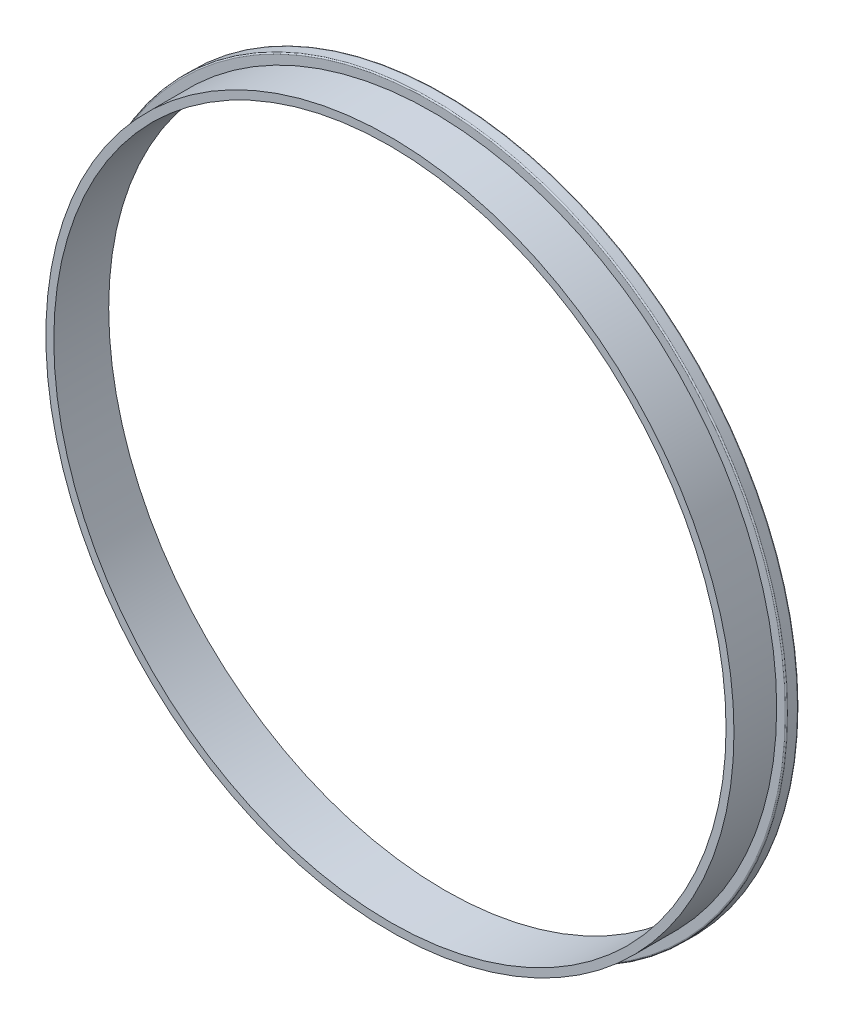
SolidWorks part; units mm, degrees
ref_plane "前视基准面" through (0, 0, 0) normal (0, 0, 1) x (1, 0, 0)
ref_plane "上视基准面" through (0, 0, 0) normal (0, 1, 0) x (1, 0, 0)
ref_plane "右视基准面" through (0, 0, 0) normal (1, 0, 0) x (0, 0, -1)
sketch "草图1" plane through (0, 0, 0) normal (0, 0, 1) x (1, 0, 0)
  circle A0 centre (0, 0) radius 58
  circle A1 centre (0, 0) radius 55.1
  dimension "D1" = 116
  dimension "D2" = 110.2
extrude "凸台-拉伸1" add sketch "草图1" along normal blind 9
sketch "草图2" plane through (0, 0, 9) normal (0, 0, 1) x (1, 0, 0)
  circle A0 centre (0, 0) radius 56.4
  dimension "D1" = 112.8
extrude "切除-拉伸1" cut sketch "草图2" against normal blind 7 flip side to cut
fillet "圆角1" radius 0.2 2 edges at (58, 0, 2) (58, 0, 0)
